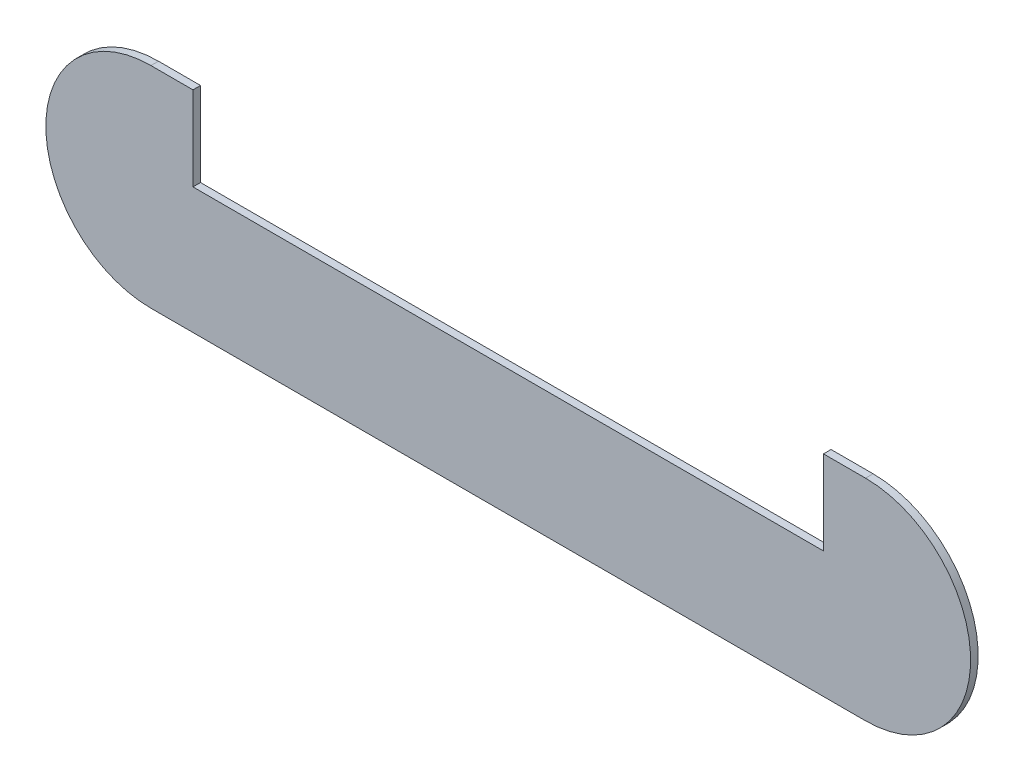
SolidWorks part; units mm, degrees
ref_plane "Plan de face" through (0, 0, 0) normal (0, 0, 1) x (1, 0, 0)
ref_plane "Plan de dessus" through (0, 0, 0) normal (0, 1, 0) x (1, 0, 0)
ref_plane "Plan de droite" through (0, 0, 0) normal (1, 0, 0) x (0, 0, -1)
sketch "Esquisse1" plane through (0, 0, 0) normal (0, 0, 1) x (1, 0, 0)
  line L1 (-850, -250) -> (850, -250)
  line L3 (-850, 250) -> (850, 250)
  arc A0 (-850, 250) -> (-850, -250) centre (-850, 0) ccw
  arc A1 (850, -250) -> (850, 250) centre (850, 0) ccw
  point P0 (0, 0)
  dimension "D3" = 500
  dimension "D5" = 500
extrude "Boss.-Extru.1" add sketch "Esquisse1" along normal blind 18
sketch "Esquisse2" plane through (0, 0, 18) normal (0, 0, 1) x (1, 0, 0)
  line L0 (850, 250) -> (750, 250) construction
  line L1 (850, 250) -> (-850, 250) construction
  line L2 (-850, 250) -> (-750, 250) construction
  line L3 (-750, 250) -> (-750, 50)
  line L4 (-750, 50) -> (750, 50)
  line L5 (750, 50) -> (750, 250)
  dimension "D1" = 100
  dimension "D2" = 100
  dimension "D3" = 200
extrude "Enlèv. mat.-Extru.1" cut sketch "Esquisse2" against normal blind 18 and the other way through all
